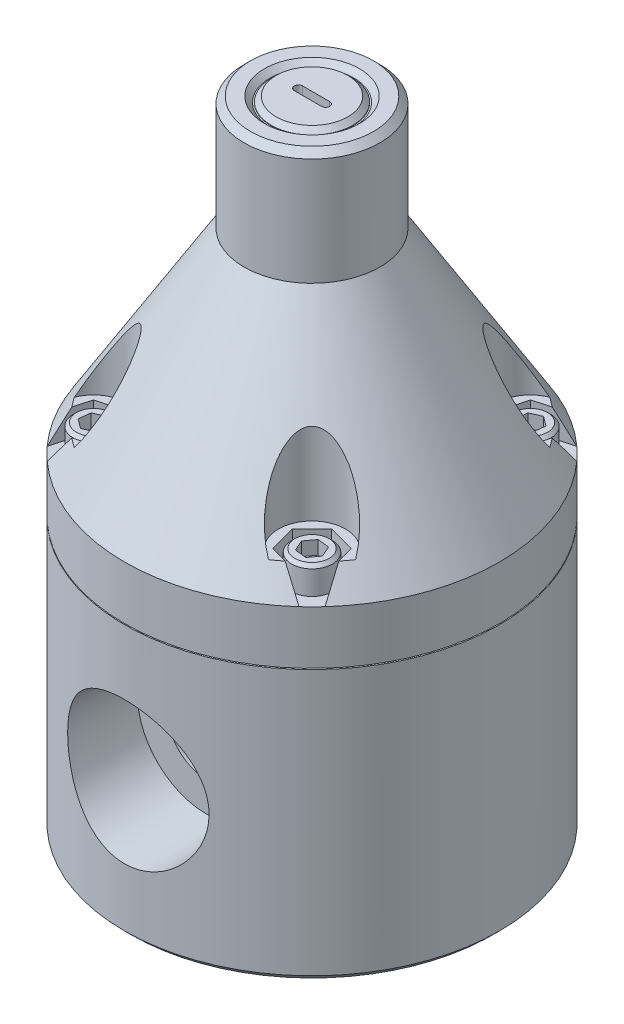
SolidWorks part; units mm, degrees
ref_plane "Front Plane" through (0, 0, 0) normal (0, 0, 1) x (1, 0, 0)
ref_plane "Top Plane" through (0, 0, 0) normal (0, 1, 0) x (1, 0, 0)
ref_plane "Right Plane" through (0, 0, 0) normal (1, 0, 0) x (0, 0, -1)
sketch "Sketch1" plane through (0, 0, 0) normal (0, 1, 0) x (1, 0, 0)
  circle A0 centre (0, 0) radius 43.815
  dimension "D1" = 87.63
extrude "Extrude1" add sketch "Sketch1" along normal blind 148.59
sketch "Sketch2" plane through (0, 0, 0) normal (0, 0, 1) x (1, 0, 0)
  line L0 (0, 148.59) -> (0, 0) construction
  line L1 (43.815, 148.59) -> (-43.815, 148.59) construction
  line L2 (-52.6288, 63.5) -> (-30.226, 63.5)
  line L4 (-30.226, 63.5) -> (-30.226, 63.754)
  line L5 (-30.226, 63.754) -> (-43.815, 63.754)
  line L7 (-43.815, 63.754) -> (-43.815, 76.2)
  line L8 (-43.815, 76.2) -> (-15.875, 121.92)
  line L9 (-15.875, 121.92) -> (-15.875, 152.4)
  line L10 (-15.875, 152.4) -> (-52.6288, 152.4)
  line L11 (-52.6288, 152.4) -> (-52.6288, 63.5)
  line L12 (-43.815, 0) -> (43.815, 0) construction
  dimension "D1" = 43.815
  dimension "D2" = 15.875
  dimension "D3" = 63.5
  dimension "D4" = 30.226
  dimension "D5" = 0.254
  dimension "D6" = 76.2
  dimension "D7" = 152.4
  dimension "D8" = 121.92
revolve "Cut-Revolve1" cut sketch "Sketch2" angle 360 about L0
chamfer "Chamfer1" distance 1.524 angle 45 2 edges at (0, 0, 43.815) (0, 148.59, 15.875)
ref_plane "Plane1" through (0, 148.59, 0) normal (0, 1, 0) x (-1, 0, 0)
sketch "Sketch3" plane through (0, 148.59, 0) normal (0, 1, 0) x (-1, 0, 0)
  circle A0 centre (0, 0) radius 11.1125
  dimension "D1" = 22.225
extrude "Extrude2" cut sketch "Sketch3" against normal blind 1.27 draft 45
sketch "Sketch4" plane through (0, 148.59, 0) normal (0, 1, 0) x (-1, 0, 0)
  circle A0 centre (0, 0) radius 9.525
  dimension "D1" = 19.05
extrude "Extrude3" add sketch "Sketch4" against normal up to surface (1.27 mm away)
chamfer "Chamfer2" distance 1.143 angle 45 1 edges at (0, 148.59, 9.525)
sketch "Sketch5" plane through (0, 148.59, 0) normal (0, 1, 0) x (-1, 0, 0)
  line L0 (3.175, 0) -> (-3.175, 0) construction
  line L1 (3.175, 0.9652) -> (-3.175, 0.9652)
  line L2 (-3.175, -0.9652) -> (3.175, -0.9652)
  arc A0 (-3.175, 0.9652) -> (-3.175, -0.9652) centre (-3.175, 0) ccw
  arc A1 (3.175, -0.9652) -> (3.175, 0.9652) centre (3.175, 0) ccw
  dimension "D1" = 3.175
  dimension "D2" = 6.35
  dimension "D3" = 0.9652
  dimension "D4" = 0.9652
extrude "Extrude4" cut sketch "Sketch5" against normal blind 3.175 draft 1
ref_plane "Plane2" through (0, 82.55, 0) normal (0, 1, 0) x (-1, 0, 0)
sketch "Sketch6" plane through (0, 82.55, 0) normal (0, 1, 0) x (-1, 0, 0)
  line L0 (0, 0) -> (-30.9819, 30.9819) construction
  circle A0 centre (0, 0) radius 36.0934 construction
  circle A1 centre (0, 0) radius 43.815 construction
  circle A2 centre (-25.5219, 25.5219) radius 7.874
  dimension "D1" = 15.748
extrude "Extrude5" cut sketch "Sketch6" along normal blind 22.86
sketch "Sketch7" plane through (0, 82.55, 0) normal (0, 1, 0) x (-1, 0, 0)
  line L0 (0, 0) -> (-25.5219, 25.5219) construction
  line L1 (-25.5219, 25.5219) -> (-31.0896, 19.9541) construction
  line L2 (-25.5219, 25.5219) -> (-19.9541, 31.0896) construction
  line L3 (-25.5219, 25.5219) -> (-39.3911, 39.3911) construction
  line L4 (-30.0845, 20.9593) -> (-23.8519, 19.2893)
  line L5 (-23.8519, 19.2893) -> (-19.2893, 23.8519)
  line L6 (-19.2893, 23.8519) -> (-20.9593, 30.0845)
  line L10 (-30.0845, 20.9593) -> (-33.6536, 33.6536)
  line L11 (-33.6536, 33.6536) -> (-20.9593, 30.0845)
  line L13 (-27.1919, 31.7545) -> (-31.7545, 27.1919)
  line L14 (-20.9593, 30.0845) -> (-27.1919, 31.7545)
  line L15 (-31.7545, 27.1919) -> (-30.0845, 20.9593)
  arc A0 (-32.8666, 22.6837) -> (-22.6837, 32.8666) centre (-25.5219, 25.5219) ccw construction
  circle A1 centre (-25.5219, 25.5219) radius 5.588 construction
extrude "Extrude6" cut sketch "Sketch7" against normal blind 6.35
sketch "Sketch8" plane through (0, 82.55, 0) normal (0, 1, 0) x (-1, 0, 0)
  circle A0 centre (-25.5219, 25.5219) radius 4.7625
  dimension "D1" = 9.525
extrude "Extrude7" add sketch "Sketch8" against normal up to surface (6.35 mm away)
sketch "Sketch9" plane through (0, 82.55, 0) normal (0, 1, 0) x (-1, 0, 0)
  line L1 (-23.8739, 27.7452) -> (-26.6233, 28.0608)
  line L2 (-26.6233, 28.0608) -> (-28.2713, 25.8375)
  line L3 (-28.2713, 25.8375) -> (-27.1699, 23.2986)
  line L4 (-27.1699, 23.2986) -> (-24.4205, 22.983)
  line L5 (-24.4205, 22.983) -> (-22.7725, 25.2063)
  line L6 (-22.7725, 25.2063) -> (-23.8739, 27.7452)
  circle A0 centre (-25.5219, 25.5219) radius 2.3967 construction
extrude "Extrude8" cut sketch "Sketch9" against normal blind 3.175
pattern_circular "CirPattern1" count 4 over 360 about axis through (0, 0, 0) along (0, 1, 0) of "Extrude5", "Extrude6", "Extrude7", "Extrude8"
chamfer "Chamfer3" distance 0.762 angle 45 4 edges at (25.5219, 82.55, 30.2844) (30.2844, 82.55, -25.5219) (-25.5219, 82.55, -30.2844) (-30.2844, 82.55, 25.5219)
ref_plane "Plane3" through (0, 0, 43.815) normal (0, 0, 1) x (1, 0, 0)
hole_wizard "1 Rc Tapped Hole1" positions "3DSketch1" profile "Sketch12" size "1" standard "BSI"
sketch3d "3DSketch1"
  point P0 (0, 31.75, 43.815)
sketch "Sketch12" plane through (0, 31.75, 43.815) normal (1, 0, 0) x (0, -1, 0)
  line L0 (0, 0) -> (0, 35.8877)
  line L1 (9, 30.48) -> (0, 35.8877)
  line L2 (-9, 30.48) -> (0, 35.8877) construction
  line L3 (9, 30.48) -> (9, 19.05)
  line L4 (9, 19.05) -> (16.0314, 19.05)
  line L5 (16.0314, 19.05) -> (16.6261, 0)
  line L6 (-16.0314, 19.05) -> (-16.6261, 0) construction
  line L7 (16.6261, 0) -> (0, 0)
  line L8 (0, -6.35) -> (0, 107.95) construction
  line L11 (-9, 19.05) -> (-16.0314, 19.05) construction
  dimension "Tap Drill Dia." = 18
  dimension "Tap Drill Depth" = 30.48
  dimension "Thread Dia." = 33.2521
  dimension "Thread Angle" = 3.576
  dimension "Thread Depth" = 19.05
  dimension "Drill Angle" = 118
mirror "Mirror1" about plane through (0, 0, 0) normal (0, 0, 1) of "1 Rc Tapped Hole1"
